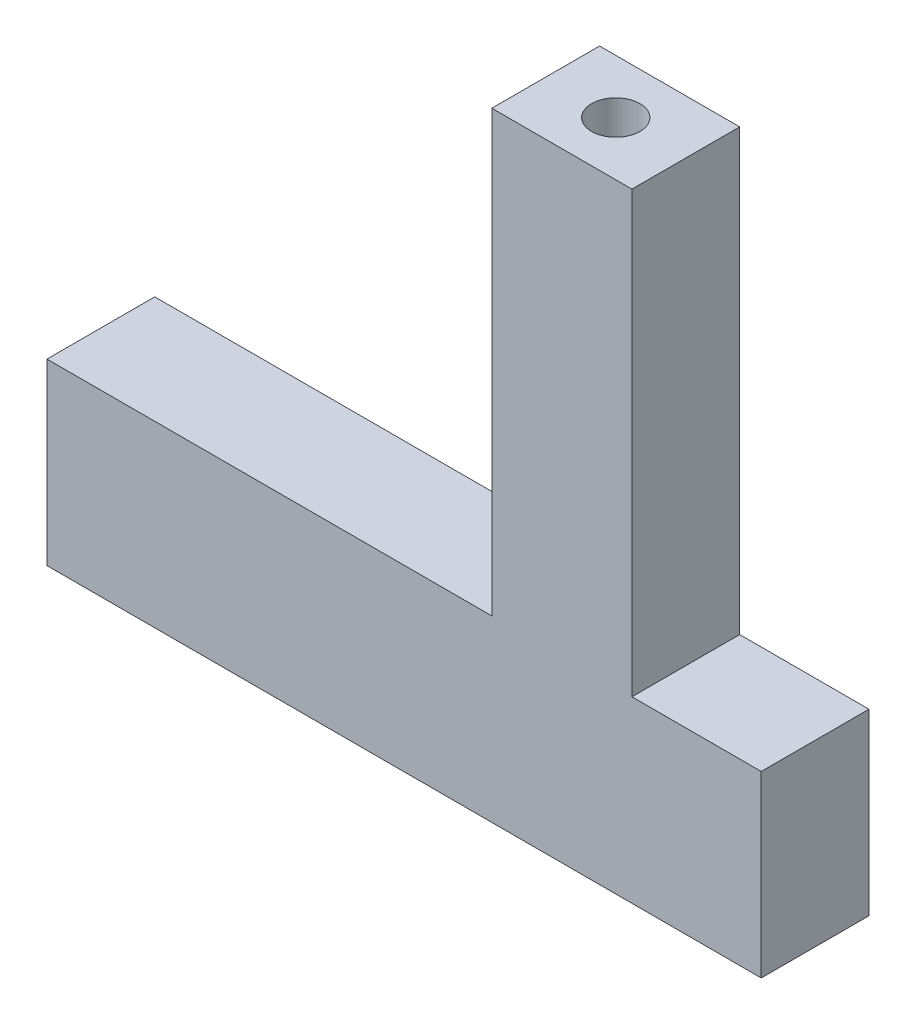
SolidWorks part; units mm, degrees
ref_plane "Front Plane" through (0, 0, 0) normal (0, 0, 1) x (1, 0, 0)
ref_plane "Top Plane" through (0, 0, 0) normal (0, 1, 0) x (1, 0, 0)
ref_plane "Right Plane" through (0, 0, 0) normal (1, 0, 0) x (0, 0, -1)
sketch "Sketch1" plane through (0, 0, 0) normal (0, 0, 1) x (1, 0, 0)
  line L0 (-42.0878, 0) -> (0, 0)
  line L1 (0, 0) -> (0, 10.541)
  line L2 (0, 10.541) -> (-7.62, 10.541)
  line L3 (-7.62, 10.541) -> (-7.62, 36.449)
  line L4 (-7.62, 36.449) -> (-15.875, 36.449)
  line L5 (-15.875, 36.449) -> (-15.875, 10.541)
  line L6 (-15.875, 10.541) -> (-42.0878, 10.541)
  line L7 (-42.0878, 10.541) -> (-42.0878, 0)
  dimension "D1" = 10.541
  dimension "D2" = 42.0878
  dimension "D3" = 25.908
  dimension "D4" = 8.255
  dimension "D5" = 26.2128
extrude "Extrude1" add sketch "Sketch1" along normal blind 6.35
sketch "Sketch2" plane through (0, 36.449, 0) normal (0, 1, 0) x (-1, 0, 0)
  line L0 (11.7475, 0) -> (11.7475, 6.35) construction
  line L1 (7.62, 0) -> (15.875, 0) construction
  line L2 (7.62, 6.35) -> (15.875, 6.35) construction
hole_wizard "#4-40 Tapped Hole1" positions "3DSketch1" profile "Sketch3" tap size "#4-40" standard "Ansi Inch"
sketch3d "3DSketch1"
  line L1 (-11.7475, 36.449, 0) -> (-11.7475, 36.449, 6.35) construction
  point P6 (-11.7475, 36.449, 3.175)
sketch "Sketch3" plane through (-11.7475, 36.449, 3.175) normal (1, 0, 0) x (0, 0, 1)
  line L0 (0, 0) -> (0, 15.4112)
  line L1 (0, 15.4112) -> (1.1303, 14.732)
  line L2 (1.1303, 14.732) -> (1.1303, 12.7)
  line L3 (1.1303, 12.7) -> (1.4224, 12.7)
  line L4 (1.4224, 12.7) -> (1.4224, 0)
  line L5 (1.4224, 0) -> (0, 0)
  line L10 (0, 15.4112) -> (-1.1303, 14.732) construction
  line L11 (0, -6.35) -> (0, 107.95) construction
  dimension "Tap Drill Dia." = 2.2606
  dimension "Tap Drill Depth" = 14.732
  dimension "Thread Major Dia." = 2.8448
  dimension "Thread Depth" = 12.7
  dimension "Drill Angle" = 118
